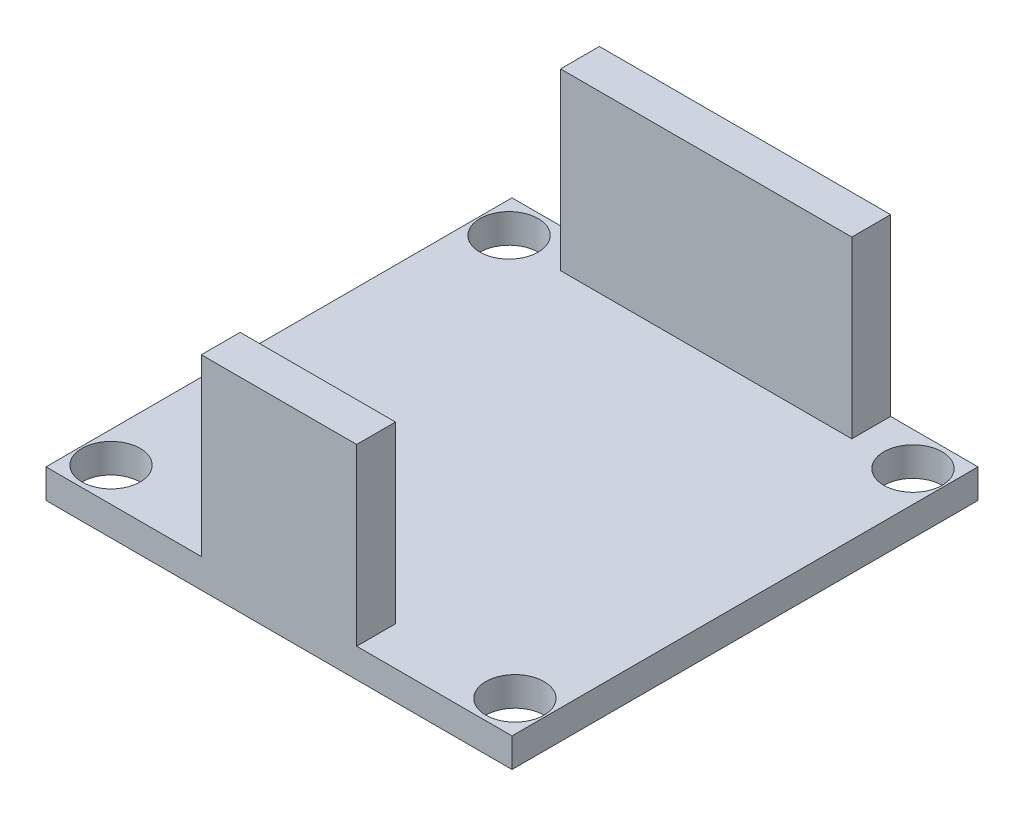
SolidWorks part; units mm, degrees
ref_plane "Front Plane" through (0, 0, 0) normal (0, 0, 1) x (1, 0, 0)
ref_plane "Top Plane" through (0, 0, 0) normal (0, 1, 0) x (1, 0, 0)
ref_plane "Right Plane" through (0, 0, 0) normal (1, 0, 0) x (0, 0, -1)
sketch "Sketch1" plane through (0, 0, 0) normal (0, 1, 0) x (1, 0, 0)
  line L1 (0, 0) -> (24, 0)
  line L2 (0, 0) -> (0, -24)
  line L3 (0, -24) -> (24, -24)
  line L4 (24, 0) -> (24, -24)
  dimension "D1" = 24
  dimension "D2" = 24
extrude "Boss-Extrude1" add sketch "Sketch1" along normal blind 1.5
sketch "Sketch2" plane through (0, 1.5, 0) normal (0, 1, 0) x (1, 0, 0)
  line L0 (12, -24) -> (12, 0) construction
  line L1 (0, -24) -> (24, -24) construction
  line L2 (24, 0) -> (0, 0) construction
  line L4 (24, -24) -> (24, 0) construction
  line L5 (24, -12) -> (0, -12) construction
  line L6 (0, 0) -> (0, -24) construction
  circle A0 centre (22.4, -1.75) radius 1.5
  circle A1 centre (22.4, -22.25) radius 1.5
  circle A2 centre (1.6, -22.25) radius 1.5
  circle A3 centre (1.6, -1.75) radius 1.5
  dimension "D1" = 3
  dimension "D2" = 1.6
  dimension "D3" = 1.75
extrude "Cut-Extrude1" cut sketch "Sketch2" against normal blind 1.5
sketch "Sketch3" plane through (0, 1.5, 0) normal (0, 1, 0) x (1, 0, 0)
  line L0 (12, 0) -> (12, -24)
  line L1 (4.5, 0) -> (19.5, 0)
  line L2 (4.5, 0) -> (4.5, -2)
  line L3 (4.5, -2) -> (19.5, -2)
  line L4 (19.5, 0) -> (19.5, -2)
  line L5 (24, 0) -> (0, 0) construction
  line L6 (0, -24) -> (24, -24) construction
  line L8 (8, -24) -> (16, -24)
  line L9 (8, -24) -> (8, -22)
  line L10 (8, -22) -> (16, -22)
  line L11 (16, -24) -> (16, -22)
  line L12 (8, -24) -> (16, -22) construction
  line L13 (8, -22) -> (16, -24) construction
  point P8 (12, 0)
  point P9 (12, -23)
  dimension "D1" = 15
  dimension "D2" = 2
  dimension "D3" = 2
  dimension "D4" = 8
extrude "Boss-Extrude2" add sketch "Sketch3" along normal blind 9 contours L10 L9 L0 M8 | L11 L10 L0 M8 | L4 L0 L3 M10 | L2 L3 L0 M10
